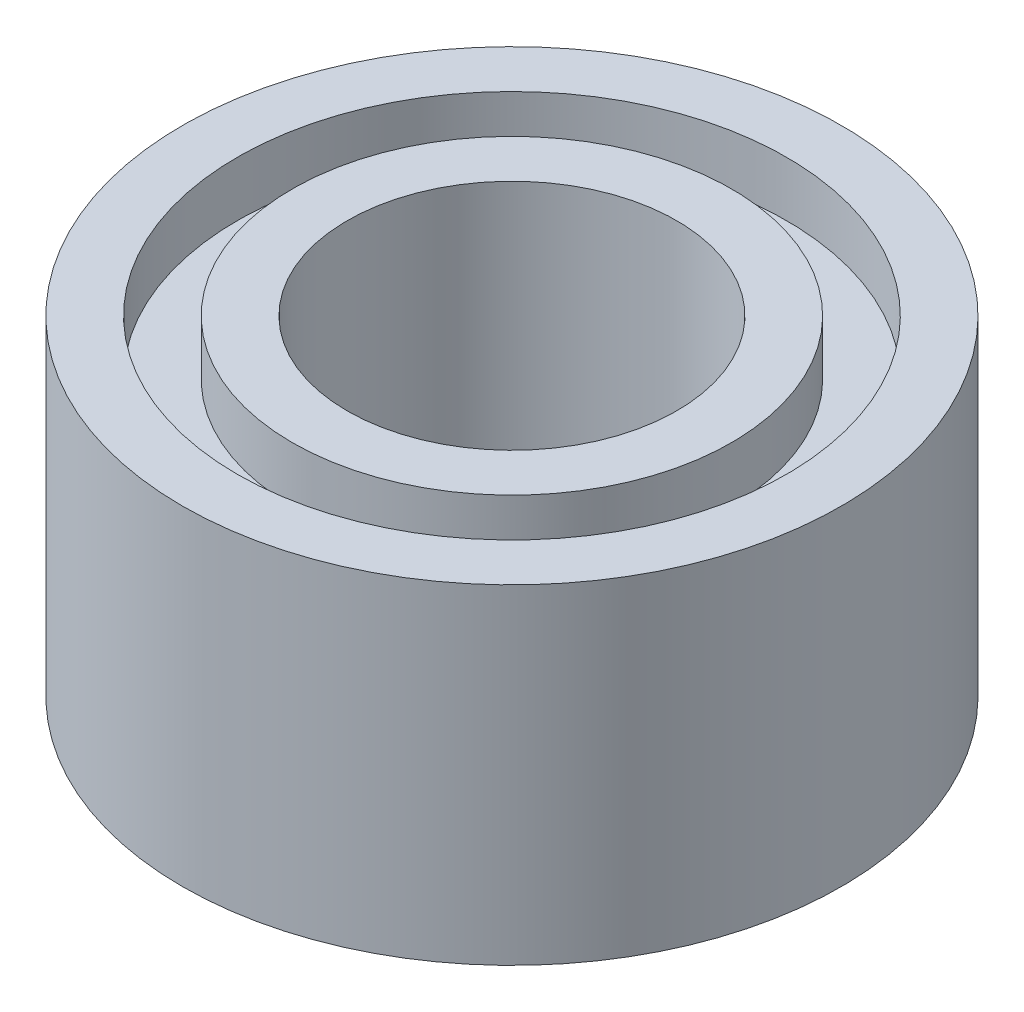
SolidWorks part; units mm, degrees
ref_plane "Front Plane" through (0, 0, 0) normal (0, 0, 1) x (1, 0, 0)
ref_plane "Top Plane" through (0, 0, 0) normal (0, 1, 0) x (1, 0, 0)
ref_plane "Right Plane" through (0, 0, 0) normal (1, 0, 0) x (0, 0, -1)
sketch "Sketch1" plane through (0, 0, 0) normal (0, 1, 0) x (1, 0, 0)
  circle A0 centre (0, 0) radius 3
  circle A1 centre (0, 0) radius 1.5
  dimension "D1" = 6
  dimension "D2" = 3
extrude "Boss-Extrude1" add sketch "Sketch1" along normal blind 3
sketch "Sketch2" plane through (0, 3, 0) normal (0, 1, 0) x (1, 0, 0)
  circle A0 centre (0, 0) radius 2
  circle A1 centre (0, 0) radius 2.5
  circle A2 centre (0, 0) radius 3 construction
  circle A3 centre (0, 0) radius 1.5 construction
  dimension "D1" = 0.5
  dimension "D2" = 0.5
extrude "Cut-Extrude1" cut sketch "Sketch2" against normal blind 0.5
sketch "Sketch3" plane through (0, 0, 0) normal (0, -1, 0) x (-1, 0, 0)
  circle A0 centre (0, 0) radius 2
  circle A1 centre (0, 0) radius 2.5
  circle A2 centre (0, 0) radius 1.5 construction
  circle A3 centre (0, 0) radius 3 construction
  dimension "D1" = 0.5
  dimension "D2" = 0.5
extrude "Cut-Extrude2" cut sketch "Sketch3" against normal blind 0.5
sketch "Sketch4" plane through (0, 0.5, 0) normal (0, -1, 0) x (-1, 0, 0)
  circle A0 centre (0, 0) radius 2.25
  circle A1 centre (0, 0) radius 2.25
  circle A2 centre (0, 0) radius 2 construction
  circle A3 centre (0, 0) radius 2.5 construction
  dimension "D1" = 0.25
  dimension "D2" = 0.25
sketch "Sketch5" plane through (0, 2.5, 0) normal (0, 1, 0) x (1, 0, 0)
  circle A0 centre (0, 0) radius 2.25
  circle A1 centre (0, 0) radius 2.25
  circle A2 centre (0, 0) radius 2 construction
  circle A3 centre (0, 0) radius 2.5 construction
  dimension "D1" = 0.25
  dimension "D2" = 0.25
